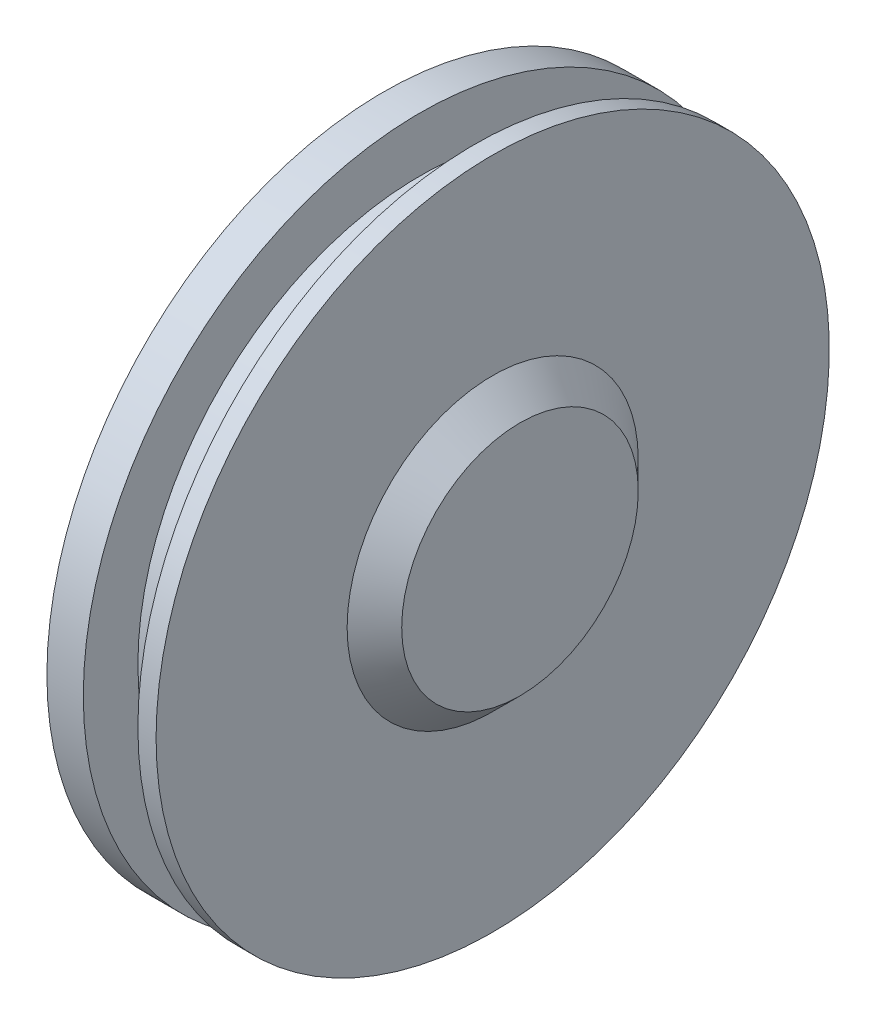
SolidWorks part; units mm, degrees
ref_plane "Plan1" through (0, 0, 0) normal (0, 0, 1) x (1, 0, 0)
ref_plane "Plan2" through (0, 0, 0) normal (0, 1, 0) x (1, 0, 0)
ref_plane "Plan3" through (0, 0, 0) normal (1, 0, 0) x (0, 0, -1)
sketch "Esquisse1" plane through (0, 0, 0) normal (0, 0, 1) x (1, 0, 0)
  line L0 (-34.3764, 41.5) -> (-19.2087, 41.5) construction
  line L1 (-30, 41.5) -> (-24, 41.5)
  line L3 (-30, 41.5) -> (-30, 60)
  line L4 (-30, 60) -> (-28, 60)
  line L5 (-28, 60) -> (-28, 57)
  line L6 (-28, 57) -> (-25, 57)
  line L7 (-25, 57) -> (-25, 60)
  line L8 (-25, 60) -> (-24, 60)
  line L9 (-24, 60) -> (-24, 41.5)
  dimension "D1" = 2
  dimension "D2" = 3
  dimension "D3" = 1
  dimension "D4" = 3
  dimension "D5" = 18.5
revolve "Base-Révolution" add sketch "Esquisse1" angle 360 about L0
sketch "Esquisse2" plane through (-24, 0, 0) normal (1, 0, 0) x (0, 0, -1)
  circle A0 centre (0, 41.5) radius 8
  dimension "D1" = 16
extrude "Boss.-Extru.1" add sketch "Esquisse2" along normal blind 1.5
chamfer "Chanfrein1" distance 1.5 angle 45
